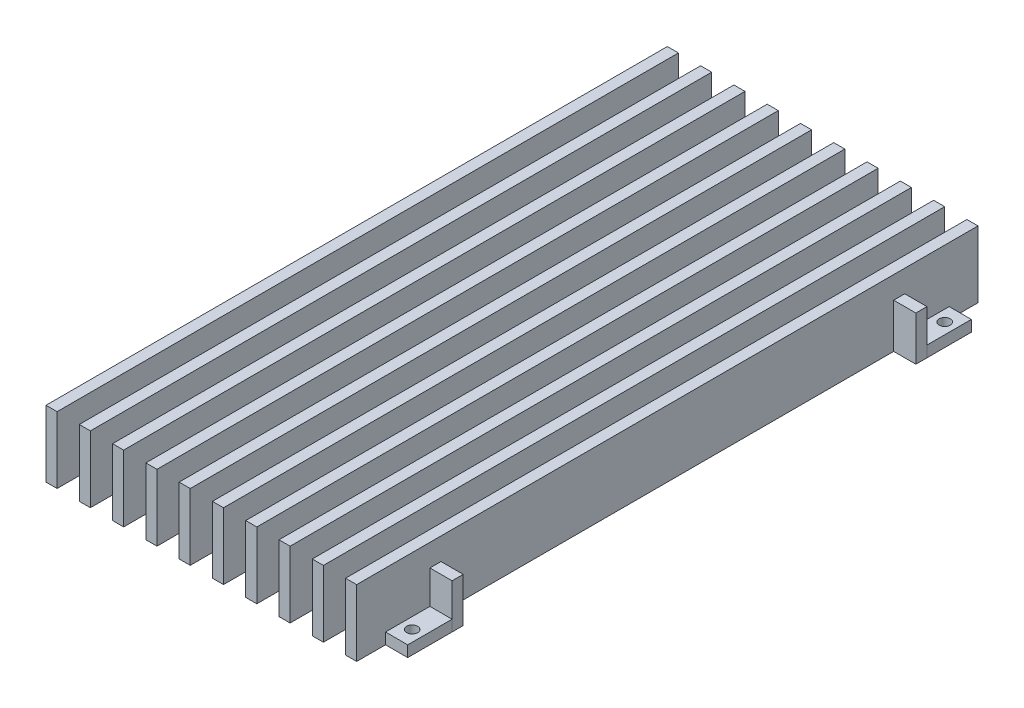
SolidWorks part; units mm, degrees
ref_plane "Front Plane" through (0, 0, 0) normal (0, 0, 1) x (1, 0, 0)
ref_plane "Top Plane" through (0, 0, 0) normal (0, 1, 0) x (1, 0, 0)
ref_plane "Right Plane" through (0, 0, 0) normal (1, 0, 0) x (0, 0, -1)
sketch "Sketch1" plane through (0, 0, 0) normal (0, 0, 1) x (1, 0, 0)
  line L1 (1.5875, -9.525) -> (-1.5875, -9.525)
  line L2 (1.5875, -9.525) -> (1.5875, 9.525)
  line L3 (1.5875, 9.525) -> (-1.5875, 9.525)
  line L4 (-1.5875, -9.525) -> (-1.5875, 9.525)
  line L5 (1.5875, -9.525) -> (-1.5875, 9.525) construction
  line L6 (1.5875, 9.525) -> (-1.5875, -9.525) construction
  point P0 (0, 0)
  dimension "D1" = 3.175
  dimension "D2" = 19.05
extrude "Boss-Extrude1" add sketch "Sketch1" against normal blind 177.8
pattern_linear "LPattern1" count 10 spacing 9.525 along (1, 0, 0)
ref_plane "Plane1" through (42.8625, 0, 0) normal (-1, 0, 0) x (0, 0, 1)
sketch "Sketch2" plane through (42.8625, 0, 0) normal (-1, 0, 0) x (0, 0, 1)
  line L0 (-177.8, -9.525) -> (0, -9.525) construction
  line L1 (-156.845, -9.525) -> (-153.67, -9.525)
  line L2 (-156.845, -9.525) -> (-156.845, 3.175)
  line L3 (-156.845, 3.175) -> (-153.67, 3.175)
  line L4 (-153.67, -9.525) -> (-153.67, 3.175)
  line L5 (-88.9, 9.525) -> (-88.9, -9.525) construction
  line L6 (-177.8, 9.525) -> (0, 9.525) construction
  line L7 (-24.13, -9.525) -> (-24.13, 3.175)
  line L8 (-20.955, 3.175) -> (-24.13, 3.175)
  line L9 (-20.955, -9.525) -> (-20.955, 3.175)
  line L10 (-20.955, -9.525) -> (-24.13, -9.525)
  dimension "D1" = 12.7
  dimension "D2" = 3.175
  dimension "D3" = 64.77
extrude "Boss-Extrude2" add sketch "Sketch2" along normal mid plane 101.6
sketch "Sketch3" plane through (0, -9.525, 0) normal (0, -1, 0) x (1, 0, 0)
  line L0 (-7.9375, -24.13) -> (-7.9375, -20.955) construction
  line L1 (-1.5875, -20.955) -> (-7.9375, -20.955)
  line L2 (-1.5875, -20.955) -> (-1.5875, -8.255)
  line L3 (-1.5875, -8.255) -> (-7.9375, -8.255)
  line L4 (-7.9375, -20.955) -> (-7.9375, -8.255)
  line L5 (-1.5875, -177.8) -> (-1.5875, -156.845) construction
  line L6 (-7.9375, -156.845) -> (-1.5875, -156.845)
  line L7 (-7.9375, -156.845) -> (-7.9375, -169.545)
  line L8 (-7.9375, -169.545) -> (-1.5875, -169.545)
  line L9 (-1.5875, -156.845) -> (-1.5875, -169.545)
  line L10 (87.3125, -177.8) -> (87.3125, -156.845) construction
  line L11 (93.6625, -156.845) -> (87.3125, -156.845)
  line L12 (93.6625, -156.845) -> (93.6625, -169.545)
  line L13 (93.6625, -169.545) -> (87.3125, -169.545)
  line L14 (87.3125, -156.845) -> (87.3125, -169.545)
  line L15 (87.3125, -20.955) -> (87.3125, 0) construction
  line L16 (93.6625, -20.955) -> (87.3125, -20.955)
  line L17 (93.6625, -20.955) -> (93.6625, -8.255)
  line L18 (93.6625, -8.255) -> (87.3125, -8.255)
  line L19 (87.3125, -20.955) -> (87.3125, -8.255)
  dimension "D1" = 12.7
extrude "Boss-Extrude3" add sketch "Sketch3" against normal blind 3.175 separate body
sketch "Sketch4" plane through (0, -6.35, 0) normal (0, 1, 0) x (1, 0, 0)
  line L0 (90.4875, 165.1) -> (-4.7625, 165.1) construction
  line L1 (42.8625, 165.1) -> (42.8625, 148.7523) construction
  circle A3 centre (90.4875, 165.1) radius 1.5875
  circle A4 centre (-4.7625, 165.1) radius 1.5875
  circle A5 centre (-4.7625, 12.7) radius 1.5875
  circle A6 centre (90.4875, 12.7) radius 1.5875
extrude "Cut-Extrude1" cut sketch "Sketch4" against normal blind 3.175 contours A6 | A5 | A4 | A3
